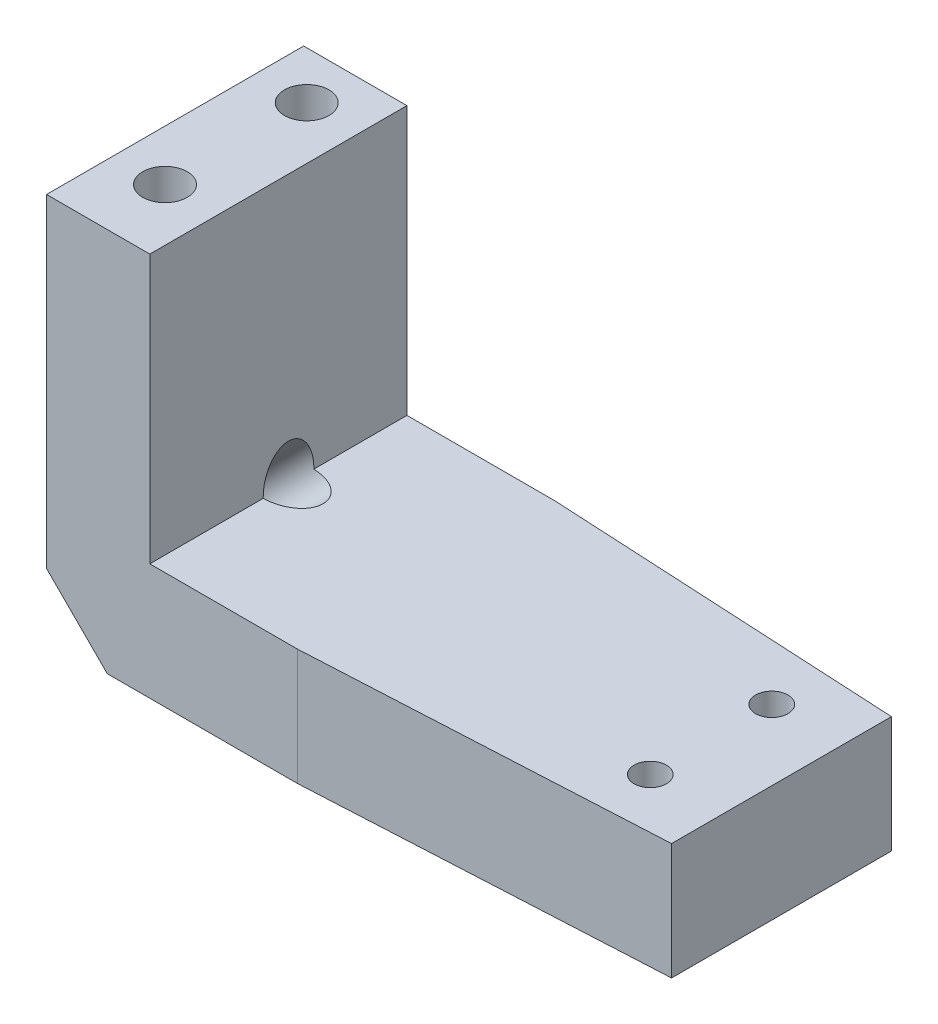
SolidWorks part; units mm, degrees
ref_plane "Front Plane" through (0, 0, 0) normal (0, 0, 1) x (1, 0, 0)
ref_plane "Top Plane" through (0, 0, 0) normal (0, 1, 0) x (1, 0, 0)
ref_plane "Right Plane" through (0, 0, 0) normal (1, 0, 0) x (0, 0, -1)
sketch "Sketch1" plane through (0, 0, 0) normal (0, 1, 0) x (1, 0, 0)
  line L0 (0, 7) -> (0, -7)
  line L1 (0, -7.7) -> (0, 7.7) construction
  line L2 (0, -7) -> (29.95, -5.4304)
  line L3 (29.95, -5.4304) -> (29.95, 5.4304)
  line L4 (29.95, 5.4304) -> (0, 7)
  line L5 (-7.8088, 0) -> (87.9118, 0) construction
  line L6 (-10.45, 0) -> (10.45, 0) construction
  dimension "D1" = 6
  dimension "D2" = 14
  dimension "D3" = 29.95
extrude "Boss-Extrude1" add sketch "Sketch1" along normal blind 19
sketch "Sketch11" plane through (0, 0, 0) normal (0, 0, 1) x (1, 0, 0)
  line L0 (29.95, 19) -> (29.95, 0) construction
  line L1 (0, 19) -> (29.95, 19) construction
  line L2 (7.7, 0) -> (-7.7, 0) construction
  line L3 (5.1, 5.75) -> (29.95, 5.75)
  line L4 (5.1, 5.75) -> (5.1, 19)
  line L5 (5.1, 19) -> (29.95, 19)
  line L6 (29.95, 5.75) -> (29.95, 19)
  line L7 (0, -7.7) -> (0, 7.7) construction
  dimension "D2" = 5.1
  dimension "D1" = 5.75
extrude "Cut-Extrude4" cut sketch "Sketch11" against normal through all and the other way through all
sketch "Sketch15" plane through (0, 0, 0) normal (0, 0, 1) x (1, 0, 0)
  line L0 (0, -7.7) -> (0, 7.7) construction
  line L1 (7.7, 0) -> (-7.7, 0) construction
  circle A0 centre (3.5, 3.3) radius 0.99
  dimension "D1" = 1.98
  dimension "D2" = 3.5
  dimension "D3" = 3.3
extrude "Cut-Extrude5" [suppressed] cut sketch "Sketch15" against normal through all and the other way through all
sketch "Sketch17" plane through (0, 0, 0) normal (-1, 0, 0) x (0, 0, 1)
  line L0 (7.7, 0) -> (-7.7, 0) construction
  line L1 (-5, 0) -> (-2, 0)
  line L2 (-5, 0) -> (-5, 9)
  line L3 (-5, 9) -> (-2, 9)
  line L4 (-2, 0) -> (-2, 9)
  line L5 (0, -10.45) -> (0, 10.45) construction
  line L6 (1.5, 0) -> (4.5, 0)
  line L7 (1.5, 0) -> (1.5, 9)
  line L8 (1.5, 9) -> (4.5, 9)
  line L9 (4.5, 0) -> (4.5, 9)
  dimension "D1" = 3
  dimension "D2" = 3
  dimension "D3" = 2
  dimension "D4" = 1.5
  dimension "D5" = 9
extrude "Cut-Extrude7" [suppressed] cut sketch "Sketch17" against normal blind 10
fillet "Fillet1" [suppressed] radius 5
hole_wizard "CBORE for M2 SHCS1" positions "Sketch19" profile "Sketch20" counterbore size "M2" standard "ANSI Metric"
sketch "Sketch19" plane through (0, 0, 0) normal (0, 1, 0) x (1, 0, 0)
  line L0 (0, -7.7) -> (0, 7.7) construction
  line L1 (-10.45, 0) -> (10.45, 0) construction
  point P0 (2.5, -3)
  point P2 (2.5, 4)
  dimension "D1" = 2.5
  dimension "D2" = 3
  dimension "D3" = 4
sketch "Sketch20" plane through (2.5, 0, 3) normal (1, 0, 0) x (0, 0, -1)
  line L0 (0, 0) -> (0, 19)
  line L1 (0, 19) -> (1.1, 19)
  line L3 (1.1, 19) -> (1.1, 15)
  line L4 (1.1, 15) -> (2.05, 15)
  line L5 (2.05, 15) -> (2.05, 0)
  line L7 (2.05, 0) -> (0, 0)
  line L11 (0, -6.35) -> (0, 107.95) construction
  dimension "Thru Hole Dia." = 2.2
  dimension "Thru Hole Depth" = 19
  dimension "C'Bore Dia." = 4.1
  dimension "C'Bore Depth" = 15
hole_wizard "M2x0.4 Tapped Hole1" positions "Sketch22" profile "Sketch21" tap size "M2x0.4" standard "ANSI Metric"
sketch "Sketch22" plane through (0, 0, 0) normal (0, -1, 0) x (1, 0, 0)
  line L0 (0, -7.7) -> (0, 7.7) construction
  line L1 (10.45, 0) -> (-10.45, 0) construction
  point P0 (26.4685, 3)
  point P3 (26.4685, -3)
  dimension "D1" = 26.4685
  dimension "D2" = 3
  dimension "D3" = 3
sketch "Sketch21" plane through (26.4685, 0, 3) normal (1, 0, 0) x (0, 0, -1)
  line L0 (0, 0) -> (0, 19)
  line L1 (0, 19) -> (0.8, 19)
  line L2 (0.8, 19) -> (0.8, 0)
  line L5 (0.8, 0) -> (0, 0)
  line L11 (0, -6.35) -> (0, 107.95) construction
  dimension "Thru Tap Drill Dia." = 1.6
  dimension "Thru Tap Drill Depth" = 19
chamfer "Chamfer1" distance 3 angle 45 1 edges at (0, 0, 0)
hole_wizard "M3x0.5 Tapped Hole1" positions "Sketch24" profile "Sketch23" tap size "M3x0.5" standard "ANSI Metric"
sketch "Sketch24" plane through (1.5, 1.5, 0) normal (-0.7071, -0.7071, 0) x (-0.7071, 0.7071, 0)
  line L0 (-10.45, 0) -> (10.45, 0) construction
  point P0 (0.5, 0.5)
  dimension "D1" = 0.5
  dimension "D2" = 0.5
sketch "Sketch23" plane through (1.1464, 1.8536, -0.5) normal (0, 0, 1) x (0.7071, -0.7071, 0)
  line L0 (0, 0) -> (0, 32.4916)
  line L1 (0, 32.4916) -> (1.25, 32.4916)
  line L2 (1.25, 32.4916) -> (1.25, 0)
  line L5 (1.25, 0) -> (0, 0)
  line L11 (0, -6.35) -> (0, 107.95) construction
  dimension "Thru Tap Drill Dia." = 2.5
  dimension "Thru Tap Drill Depth" = 32.4916
sketch "Sketch25" plane through (0, 0, 0) normal (0, 1, 0) x (1, 0, 0)
  line L0 (0, -7.7) -> (0, 7.7) construction
  line L1 (12.4027, 6.35) -> (0, 6.35)
  line L2 (3, -6.8428) -> (29.95, -5.4304) construction
  line L3 (12.4027, -6.35) -> (0, -6.35)
  line L4 (0, 6.35) -> (0, -6.35)
  line L5 (-10.45, 0) -> (10.45, 0) construction
  line L7 (29.95, -5.4304) -> (5.1, -6.7327) construction
  line L8 (29.95, -5.4304) -> (29.95, 5.4304) construction
  line L9 (29.95, 5.4304) -> (3, 6.8428) construction
  line L10 (12.4027, -6.35) -> (29.95, -5.4304)
  line L11 (29.95, -5.4304) -> (29.95, 5.4304)
  line L12 (29.95, 5.4304) -> (12.4027, 6.35)
  point P8 (0, 0)
  dimension "D1" = 12.7
extrude "Cut-Extrude9" cut sketch "Sketch25" along normal through all flip side to cut
